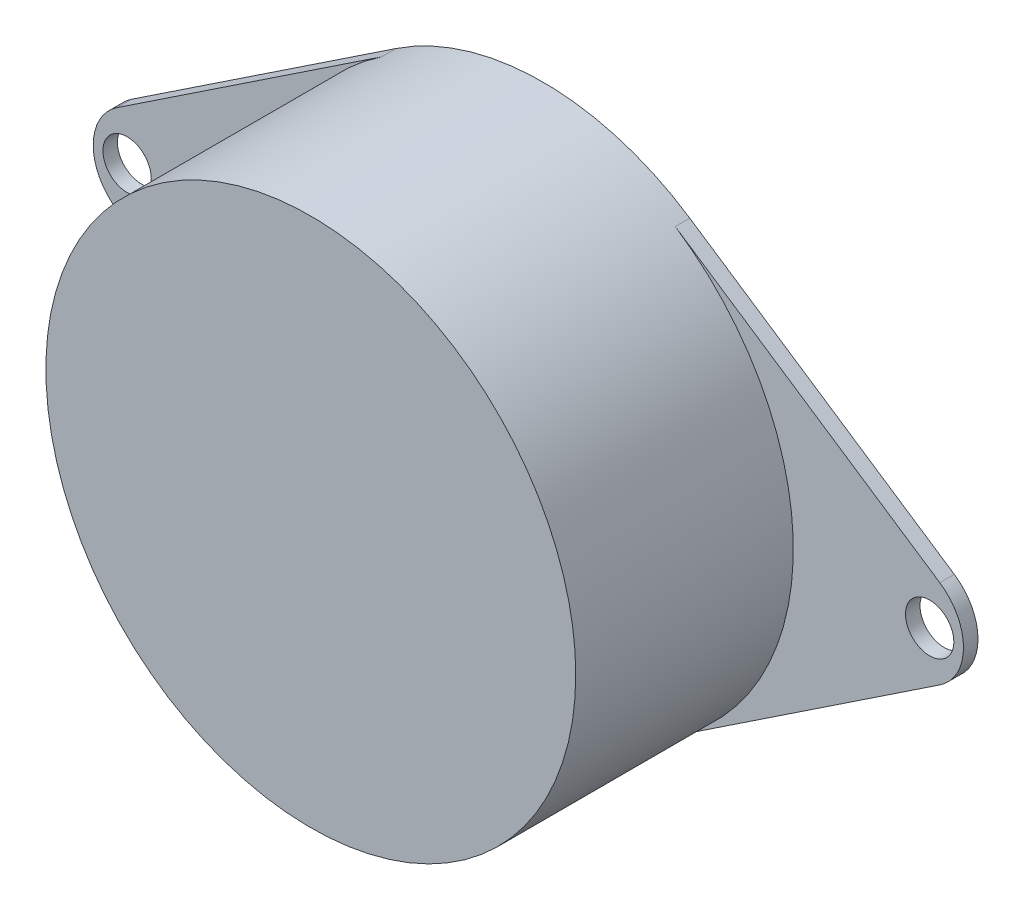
SolidWorks part; units mm, degrees
ref_plane "Plan de face" through (0, 0, 0) normal (0, 0, 1) x (1, 0, 0)
ref_plane "Plan de dessus" through (0, 0, 0) normal (0, 1, 0) x (1, 0, 0)
ref_plane "Plan de droite" through (0, 0, 0) normal (1, 0, 0) x (0, 0, -1)
sketch "Esquisse1" plane through (0, 0, 0) normal (0, 0, 1) x (1, 0, 0)
  line L0 (0, 27.4) -> (0, -27.4) construction
  line L1 (-42.5494, 4.5773) -> (-15.1914, 22.8031)
  line L2 (-42.5494, -4.5773) -> (-15.1914, -22.8031)
  line L3 (15.1914, 22.8031) -> (42.5494, 4.5773)
  line L4 (39.5, 0) -> (-39.5, 0) construction
  line L5 (15.1914, -22.8031) -> (42.5494, -4.5773)
  arc A0 (-15.1914, -22.8031) -> (15.1914, -22.8031) centre (0, 0) ccw
  arc A1 (-42.5494, 4.5773) -> (-42.5494, -4.5773) centre (-39.5, 0) ccw
  arc A2 (42.5494, -4.5773) -> (42.5494, 4.5773) centre (39.5, 0) ccw
  arc A3 (15.1914, 22.8031) -> (-15.1914, 22.8031) centre (0, 0) ccw
  dimension "D1" = 54.8
  dimension "D3" = 79
  dimension "D2" = 11
  dimension "D4" = 11
  dimension "D5" = 39.5
extrude "Extrusion1" add sketch "Esquisse1" along normal blind 1.5
sketch "Esquisse2" plane through (0, 0, 1.5) normal (0, 0, 1) x (1, 0, 0)
  circle A0 centre (0, 0) radius 27.4
  dimension "D1" = 54.8
extrude "Extrusion2" add sketch "Esquisse2" along normal blind 22.5
sketch "Esquisse3" plane through (0, 0, 1.5) normal (0, 0, 1) x (1, 0, 0)
  circle A0 centre (41.5, 0) radius 2.5
  arc A1 (42.5494, -4.5773) -> (42.5494, 4.5773) centre (39.5, 0) ccw construction
  point P2 (45, 0)
  dimension "D2" = 5
  dimension "D1" = 3.5
extrude "Enlèv. mat.-Extru.1" cut sketch "Esquisse3" against normal blind 22.5
sketch "Esquisse4" plane through (0, 0, 1.5) normal (0, 0, 1) x (1, 0, 0)
  circle A0 centre (-41.5, 0) radius 2.5
  arc A1 (-42.5494, 4.5773) -> (-42.5494, -4.5773) centre (-39.5, 0) ccw construction
  arc A2 (42.5494, -4.5773) -> (42.5494, 4.5773) centre (39.5, 0) ccw construction
  point P2 (-45, 0)
  dimension "D1" = 5
  dimension "D2" = 3.5
extrude "Enlèv. mat.-Extru.2" cut sketch "Esquisse4" against normal blind 22.5
sketch "Esquisse6" plane through (0, 0, 0) normal (0, 0, -1) x (-1, 0, 0)
  circle A0 centre (0, 0) radius 3.25
  circle A1 centre (0, 0) radius 5.4
extrude "Extrusion3" add sketch "Esquisse6" along normal blind 2
